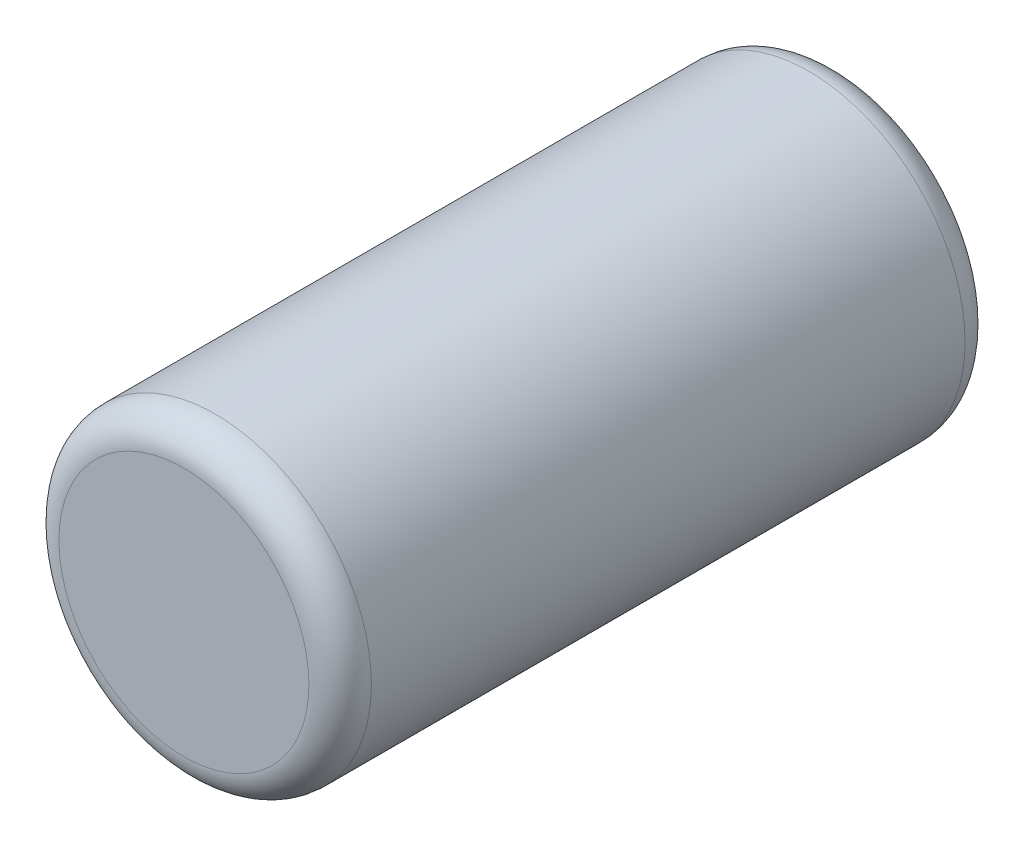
SolidWorks part; units mm, degrees
ref_plane "Face" through (0, 0, 0) normal (0, 0, 1) x (1, 0, 0)
ref_plane "Dessus" through (0, 0, 0) normal (0, 1, 0) x (1, 0, 0)
ref_plane "Droite" through (0, 0, 0) normal (1, 0, 0) x (0, 0, -1)
sketch "Esquisse1" plane through (0, 0, 0) normal (0, 0, 1) x (1, 0, 0)
  circle A0 centre (0, 0) radius 5
  dimension "D1" = 10
extrude "Base-Extrusion" add sketch "Esquisse1" along normal mid plane 21
fillet "Congé1" radius 1 2 edges at (5, 0, -10.5) (5, 0, 10.5)
